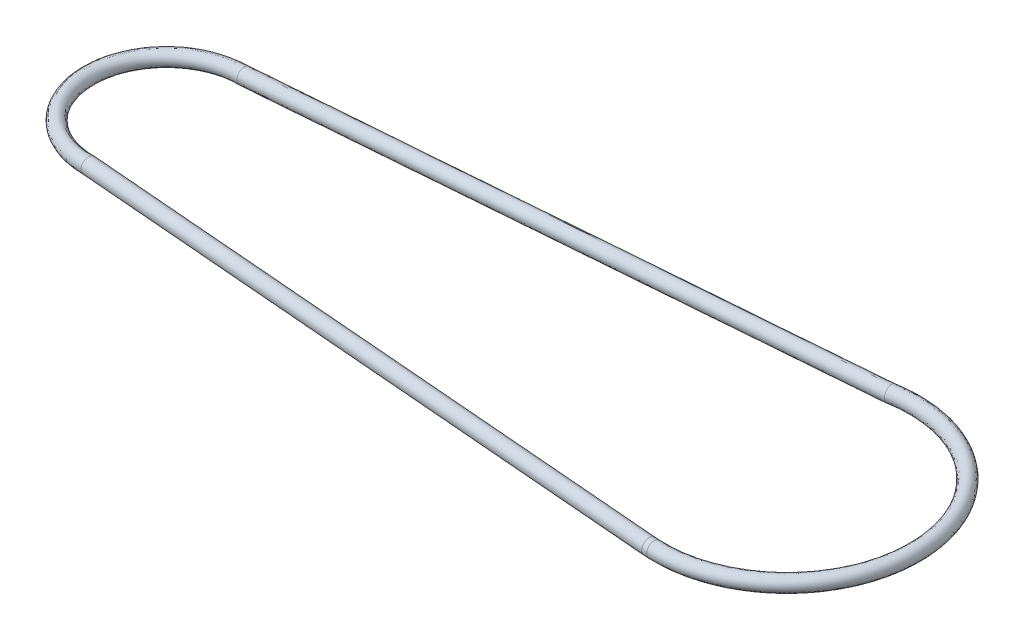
SolidWorks part; units mm, degrees
ref_plane "Front Plane" through (0, 0, 0) normal (0, 0, 1) x (1, 0, 0)
ref_plane "Top Plane" through (0, 0, 0) normal (0, 1, 0) x (1, 0, 0)
ref_plane "Right Plane" through (0, 0, 0) normal (1, 0, 0) x (0, 0, -1)
sketch "Sketch3" plane through (0, 0, 0) normal (1, 0, 0) x (0, 0, -1)
  circle A0 centre (-31.75, 0) radius 1.524
  dimension "D1" = 3.048
  dimension "1.25" = 31.75
sketch "Sketch4" plane through (0, 0, 0) normal (0, 1, 0) x (1, 0, 0)
  line L8 (-125.4111, 10.1366) -> (-3.3883, 19.9347)
  line L9 (-125.4111, -21.6632) -> (-1.0301, -31.7615)
  arc A12 (-125.4111, 10.1366) -> (-125.4111, -21.6632) centre (-125.4111, -5.7633) ccw
  arc A13 (-1.0301, -31.7615) -> (-3.3883, 19.9347) centre (1.0807, -5.7633) ccw
sweep "Sweep2" add profiles "Sketch3" path "Sketch4"
ref_plane "Plane1" through (5.08, 0, 0) normal (1, 0, 0) x (0, 0, -1)
ref_plane "Plane2" through (0, 0, 5) normal (0, 0, 1) x (1, 0, 0)
ref_plane "Plane3" through (0, 0, 0) normal (0, 1, 0) x (1, 0, 0)
ref_plane "Plane4" through (-124.92, 0, 0) normal (1, 0, 0) x (0, 0, -1)
